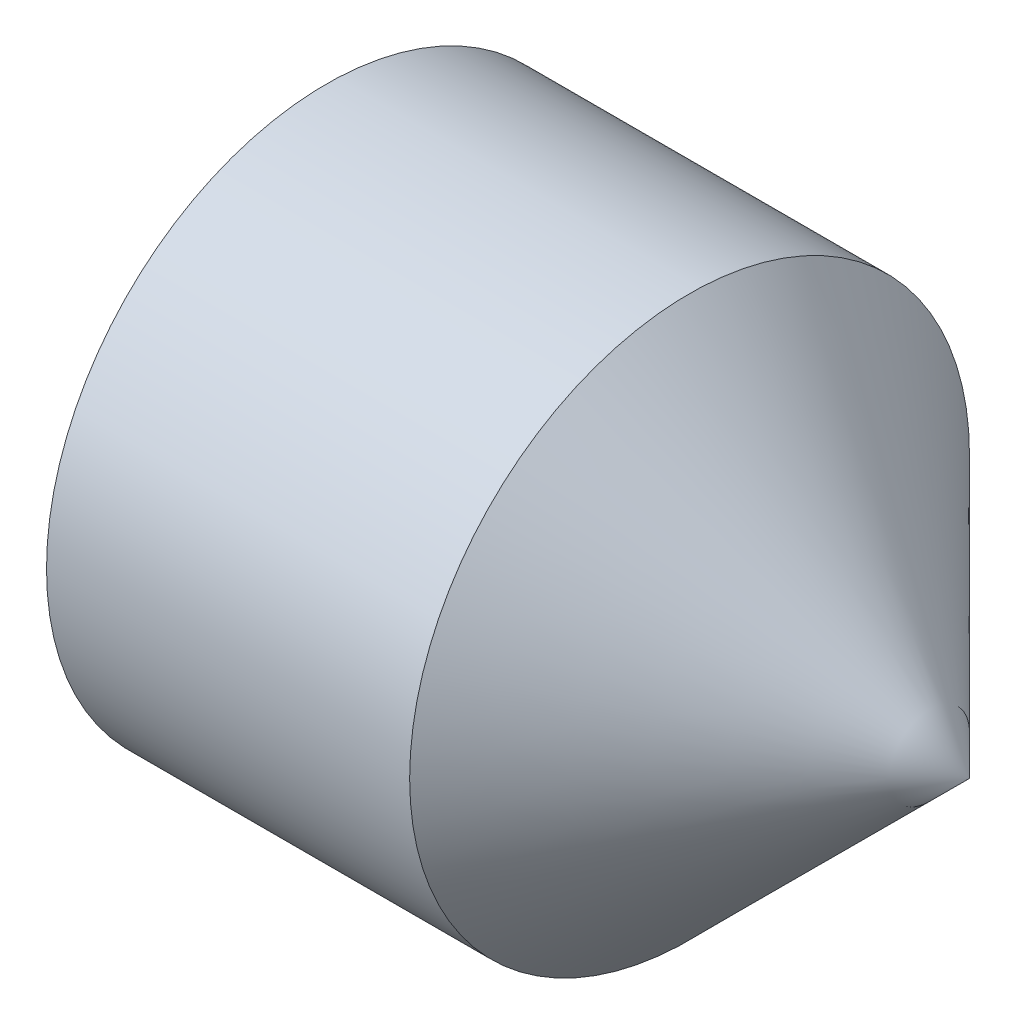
SolidWorks part; units mm, degrees
ref_plane "Plane1" through (0, 0, 0) normal (0, 0, 1) x (1, 0, 0)
ref_plane "Plane2" through (0, 0, 0) normal (0, 1, 0) x (1, 0, 0)
ref_plane "Plane3" through (0, 0, 0) normal (1, 0, 0) x (0, 0, -1)
sketch "BodySke" plane through (0, 0, 0) normal (0, 0, 1) x (1, 0, 0)
  line L0 (0, 0) -> (0, 2.055)
  line L1 (0, 2.055) -> (0.2569, 2.5)
  line L2 (0.2569, 2.5) -> (3.5, 2.5)
  line L3 (3.5, 2.5) -> (6, 0)
  line L4 (6, 0) -> (0, 0)
  line L5 (-12.7, 0) -> (88.9, 0) construction
  line L6 (3.5, -2.5) -> (6, 0) construction
  line L7 (0.4, 15.875) -> (0.4, -3.175) construction
  line L8 (0, -2.055) -> (0.2569, -2.5) construction
  dimension "Cone_ang" = 90
  dimension "Length" = 6
  dimension "Diameter" = 5
  dimension "Drive_ch_ang" = 60
  dimension "Minor_dia" = 4.11
  dimension "Advance" = 0.8
revolve "BaseBody" add sketch "BodySke" angle 360 about L5
sketch "Sketch2" plane through (0, 0, 0) normal (-1, 0, 0) x (0, 0, 1)
  line L0 (0.7217, 1.25) -> (-0.7217, 1.25)
  line L1 (-0.7217, 1.25) -> (-1.4434, 0)
  line L2 (0.7217, 1.25) -> (1.4434, 0)
  line L3 (0.7217, -1.25) -> (1.4434, 0)
  line L4 (0.7217, -1.25) -> (-0.7217, -1.25)
  line L5 (-0.7217, -1.25) -> (-1.4434, 0)
  dimension "Hex_size" = 2.5
  dimension "D2" = 1.25
  dimension "D3" = 1.25
extrude "Hex" cut sketch "Sketch2" against normal blind 3
sketch "ThdSchSke" plane through (0, 0, 0) normal (0, 0, 1) x (1, 0, 0)
  line L0 (0.2569, -2.055) -> (-0.0547, -2.5)
  line L1 (0.2569, -2.055) -> (0.5685, -2.5)
  line L2 (0.5685, -2.5) -> (0.5685, -3.125)
  line L3 (-3.175, 0) -> (5.1513, 0) construction
  line L4 (0.2569, 2.5) -> (0.2569, -2.5) construction
  line L5 (0.5685, -3.125) -> (-0.0547, -3.125)
  line L6 (-0.0547, -3.125) -> (-0.0547, -2.5)
  dimension "Thread_minor" = 4.11
  dimension "Diameter" = 5
  dimension "SideAngle" = 55
  dimension "VeeAngle" = 70
  dimension "Overcut" = 6.25
revolve "ThreadSchematic" [suppressed] cut sketch "ThdSchSke" angle 360 about L3
pattern_linear "ThdSchPat" [suppressed]
equation "\"D2@Sketch2\" = \"Hex_size@Sketch2\" / 2"
equation "\"D3@Sketch2\" = \"Hex_size@Sketch2\" / 2"
equation "\"Thread_minor@ThreadCosmetic\" = \"Minor_dia@BodySke\""
equation "\"Thread_minor@ThdSchSke\" = \"Thread_minor@ThreadCosmetic\""
equation "\"Diameter@ThdSchSke\" = \"Diameter@BodySke\""
equation "\"Overcut@ThdSchSke\" = \"Diameter@BodySke\" * 1.25"
equation "\"Num_threads@ThdSchPat\" = int( (\"Length@BodySke\" - ( ( ( \"Diameter@BodySke\" - \"Minor_dia@BodySke\" ) * 0.5 ) / tan( \"Drive_ch_ang@BodySke\" * 0.017453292 ) ) - ( ( \"Diameter@BodySke\" * 0.5 ) / tan( \"Con"
equation "\"Advance@ThdSchPat\" = (\"Length@BodySke\" - ( ( ( \"Diameter@BodySke\" - \"Minor_dia@BodySke\" ) * 0.5 ) / tan( \"Drive_ch_ang@BodySke\" * 0.017453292 ) ) - ( ( \"Diameter@BodySke\" * 0.5 ) / tan( \"Cone_ang@Bod"
equation "' \"Num_threads@ThdSchPat\" = \"Num_threads@ThdSchPat\" - sgn( \"Num_threads@ThdSchPat\" - 1) '---chamfered tips only---"
